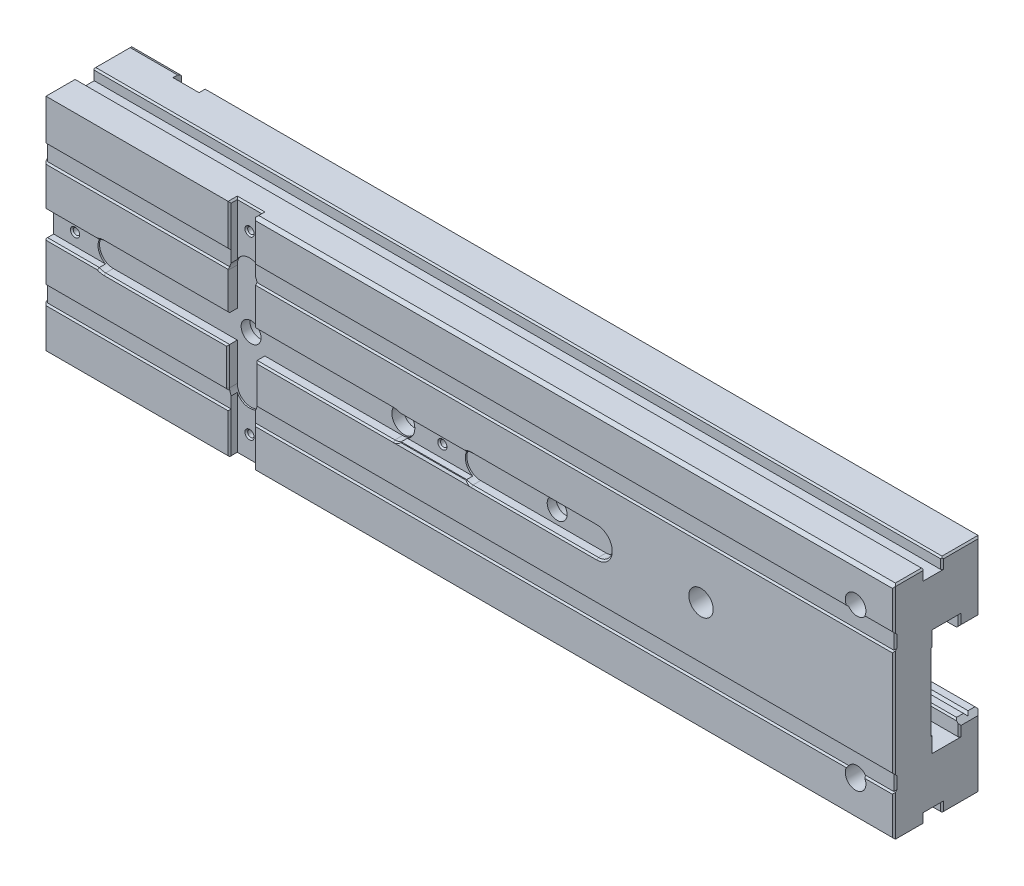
SolidWorks part; units mm, degrees
ref_plane "Front Plane" through (0, 0, 0) normal (0, 0, 1) x (1, 0, 0)
ref_plane "Top Plane" through (0, 0, 0) normal (0, 1, 0) x (1, 0, 0)
ref_plane "Right Plane" through (0, 0, 0) normal (1, 0, 0) x (0, 0, -1)
imported_body "Imported1"
sketch "Sketch1" plane through (0, 0, -24.2) normal (0, 0, -1) x (-1, 0, 0)
  circle A1 centre (-51.5, 0) radius 10
  circle A2 centre (48.5, 0) radius 12.4968
  circle A3 centre (148.5, 0) radius 10
extrude "Boss-Extrude1" add sketch "Sketch1" against normal up to surface (18.2 mm away)
sketch "Sketch2" plane through (0, 0, -24.2) normal (0, 0, -1) x (-1, 0, 0)
  circle A0 centre (-151.5, 0) radius 12.4968
extrude "Boss-Extrude2" add sketch "Sketch2" against normal up to surface (24.2 mm away)
hole_wizard "Hole1" positions "Sketch4" profile "Sketch3" legacy
sketch "Sketch4" plane through (0, 0, -24.2) normal (0, 0, -1) x (-1, 0, 0)
  line L0 (277.5, 71.5) -> (277.5, 26.5) construction
  point P0 (148.5, 0)
  point P16 (-51.5, 0)
  dimension "D1" = 129
  dimension "D2" = 200
sketch "Sketch3" plane through (-148.5, 0, -24.2) normal (1, 0, 0) x (0, 1, 0)
  line L0 (0, 0) -> (0, 100)
  line L1 (0, 100) -> (6.5, 100)
  line L2 (6.5, 100) -> (6.5, 12.5)
  line L3 (6.5, 12.5) -> (9.5, 12.5)
  line L4 (9.5, 12.5) -> (9.5, 0)
  line L5 (9.5, 0) -> (0, 0)
  line L6 (0, 110) -> (0, -10) construction
  dimension "Diameter" = 13
  dimension "Depth" = 100
  dimension "C-Bore Diameter" = 19
  dimension "C-Bore Depth" = 12.5
hole_wizard "Hole2" positions "Sketch6" profile "Sketch5" legacy
sketch "Sketch6" plane through (0, 0, -24.2) normal (0, 0, -1) x (-1, 0, 0)
  circle A0 centre (148.5, 0) radius 6.5 construction
  point P0 (48.5, 0)
  point P5 (-151.5, 0)
  dimension "D1" = 100
  dimension "D2" = 200
sketch "Sketch5" plane through (-48.5, 0, -24.2) normal (1, 0, 0) x (0, 1, 0)
  line L0 (0, 0) -> (0, 100)
  line L1 (0, 100) -> (8, 100)
  line L2 (8, 100) -> (8, 11)
  line L3 (8, 11) -> (13, 11)
  line L4 (13, 11) -> (13, 0)
  line L5 (13, 0) -> (0, 0)
  line L6 (0, 110) -> (0, -10) construction
  dimension "Diameter" = 16
  dimension "Depth" = 100
  dimension "C-Bore Diameter" = 26
  dimension "C-Bore Depth" = 11
